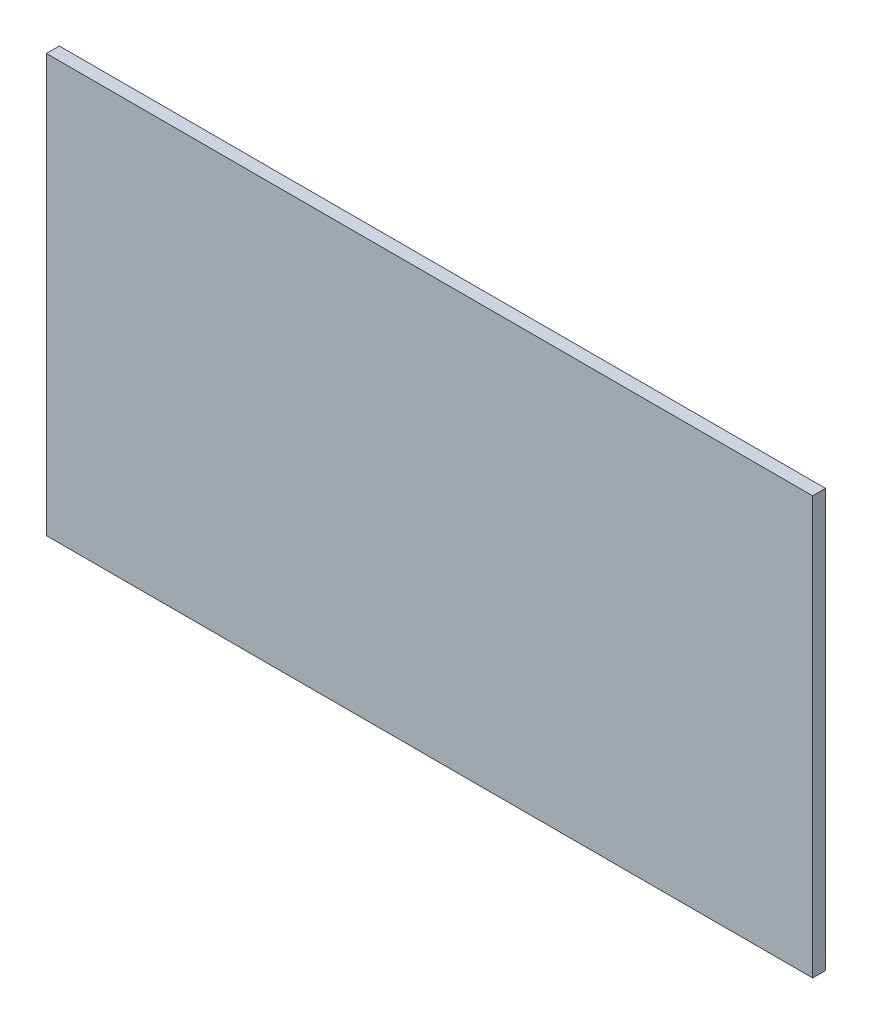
SolidWorks part; units mm, degrees
ref_plane "Front Plane" through (0, 0, 0) normal (0, 0, 1) x (1, 0, 0)
ref_plane "Top Plane" through (0, 0, 0) normal (0, 1, 0) x (1, 0, 0)
ref_plane "Right Plane" through (0, 0, 0) normal (1, 0, 0) x (0, 0, -1)
sketch "Sketch1" plane through (0, 0, 0) normal (0, 0, 1) x (1, 0, 0)
  line L1 (0, 0) -> (356, 0)
  line L2 (0, 0) -> (0, 194)
  line L3 (0, 194) -> (356, 194)
  line L4 (356, 0) -> (356, 194)
extrude "Boss-Extrude1" add sketch "Sketch1" along normal blind 6
equation "\"sheetThickness\"=0.63mm"
equation "\"flange\"= 11mm"
equation "\"baffleCutWidth\"= 28.58mm"
equation "\"baffleCutLength\"= 146.22mm"
equation "\"metalLength\" = 156.28mm"
equation "\"metalWidth\" = 35.5mm"
equation "\"pitch\" = 42mm"
equation "\"cabDepth\" = 130mm "
equation "\"overallDepth\" = \"cabDepth\" + 58mm   "
equation "\"D1@Sketch1\"=8*\"pitch\"+20"
